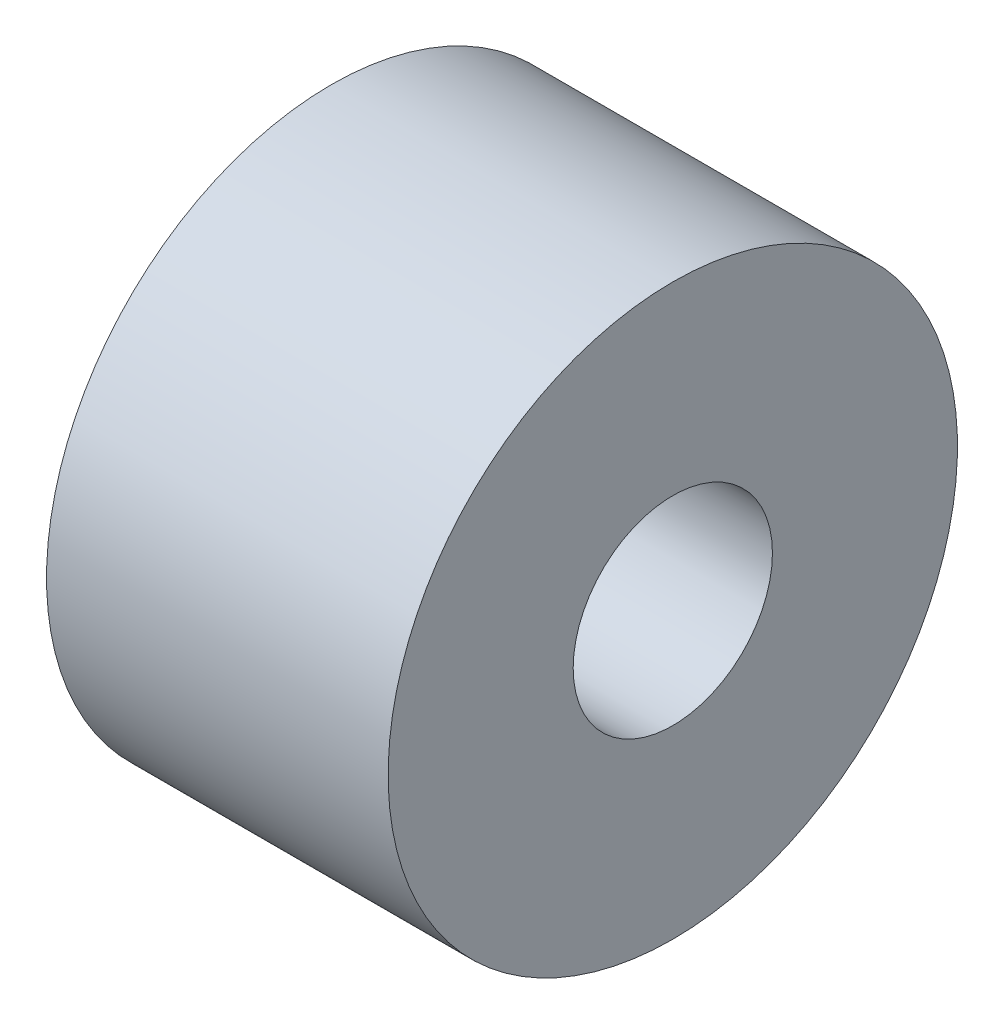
SolidWorks part; units mm, degrees
ref_plane "Front Plane" through (0, 0, 0) normal (0, 0, 1) x (1, 0, 0)
ref_plane "Top Plane" through (0, 0, 0) normal (0, 1, 0) x (1, 0, 0)
ref_plane "Right Plane" through (0, 0, 0) normal (1, 0, 0) x (0, 0, -1)
sketch "Sketch1" plane through (0, 0, 0) normal (0, 0, 1) x (1, 0, 0)
  line L1 (0, 0) -> (-6, 0)
  line L2 (0, 0) -> (0, 5)
  line L3 (0, 5) -> (-6, 5)
  line L4 (-6, 0) -> (-6, 5)
  dimension "D1" = 6
  dimension "D2" = 5
revolve "Revolve1" add sketch "Sketch1" angle 360 about L1
hole_wizard "CSK for M3 Countersunk Flat Head Screw1" positions "3DSketch1" profile "Sketch2" countersink size "M3" standard "ISO"
sketch3d "3DSketch1"
  line L0 (-6, 0, 0) -> (0, 0, 0) construction
  point P0 (-6, 0, 0)
sketch "Sketch2" plane through (-6, 0, 0) normal (0, 1, 0) x (0, 0, 1)
  line L0 (0, 0) -> (0, 6)
  line L1 (0, 6) -> (1.75, 6)
  line L2 (1.75, 6) -> (1.75, 1.4)
  line L3 (1.75, 1.4) -> (3.15, 0)
  line L5 (3.15, 0) -> (0, 0)
  line L6 (-1.75, 1.4) -> (-3.15, 0) construction
  line L11 (0, -6.35) -> (0, 107.95) construction
  dimension "Thru Hole Dia." = 3.5
  dimension "Thru Hole Depth" = 6
  dimension "Near C'Sink Dia." = 6.3
  dimension "Near C'Sink Angle" = 90
